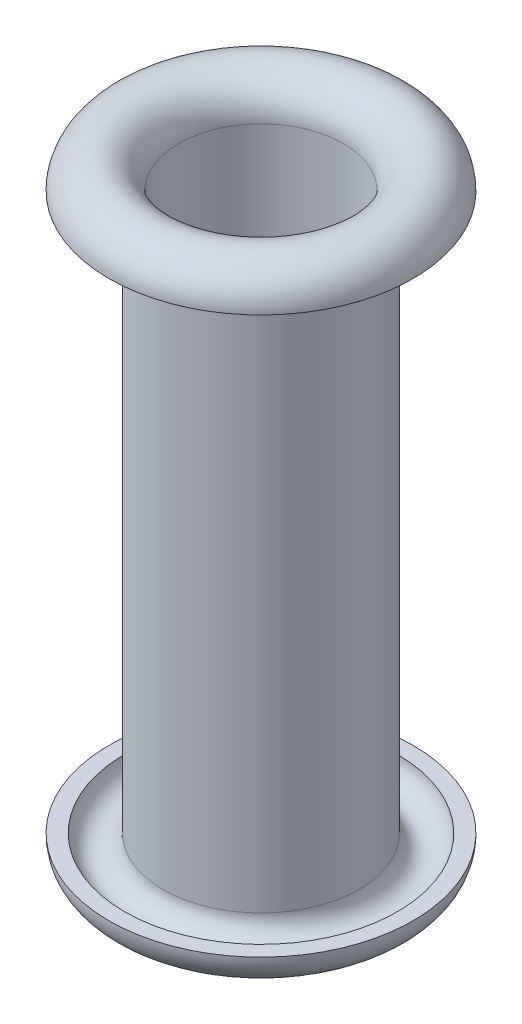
SolidWorks part; units mm, degrees
ref_plane "Front Plane" through (0, 0, 0) normal (0, 0, 1) x (1, 0, 0)
ref_plane "Top Plane" through (0, 0, 0) normal (0, 1, 0) x (1, 0, 0)
ref_plane "Right Plane" through (0, 0, 0) normal (1, 0, 0) x (0, 0, -1)
sketch "Sketch1" plane through (0, 0, 0) normal (0, 0, 1) x (1, 0, 0)
  line L0 (0, 0) -> (0, 42.6228) construction
  line L1 (1.3335, 1.8661) -> (1.3335, 10.8831)
  line L2 (1.5875, 10.8831) -> (1.5875, 1.8661)
  line L3 (1.5875, 1.8661) -> (1.3335, 1.8661) construction
  line L4 (1.899, 10.8831) -> (1.899, 1.8661) construction
  line L5 (1.5875, 1.8661) -> (1.899, 1.8661) construction
  line L6 (2.2106, 1.8661) -> (2.4646, 1.8661)
  line L7 (2.2106, 10.8831) -> (2.4646, 10.8831)
  arc A0 (2.2106, 10.8831) -> (1.5875, 10.8831) centre (1.899, 10.8831) ccw
  arc A1 (2.4646, 10.8831) -> (1.3335, 10.8831) centre (1.899, 10.8831) ccw
  arc A2 (1.5875, 1.8661) -> (2.2106, 1.8661) centre (1.899, 1.8661) ccw
  arc A3 (1.3335, 1.8661) -> (2.4646, 1.8661) centre (1.899, 1.8661) ccw
  dimension "D3" = 9.017
  dimension "D1" = 1.5875
  dimension "D2" = 0.254
revolve "Revolve1" add sketch "Sketch1" angle 360 about L0
